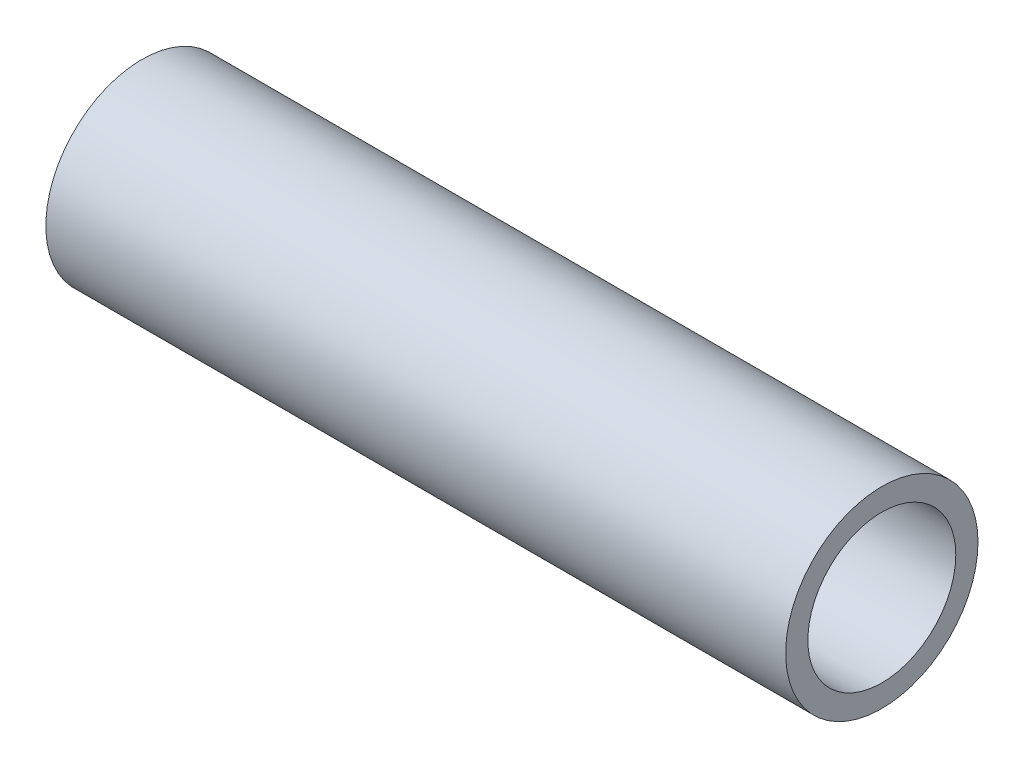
SolidWorks part; units mm, degrees
ref_plane "Front" through (0, 0, 0) normal (0, 0, 1) x (1, 0, 0)
ref_plane "Top" through (0, 0, 0) normal (0, 1, 0) x (1, 0, 0)
ref_plane "Right" through (0, 0, 0) normal (1, 0, 0) x (0, 0, -1)
sketch "Sketch1" plane through (0, 0, 0) normal (0, 0, 1) x (1, 0, 0)
  line L0 (0, 0) -> (127, 0)
  line L1 (9.9848, 0) -> (-9.9848, 0) construction
  dimension "D1" = 127
other "Structural Member1"
ref_plane "Plane1" through (0, 0, 0) normal (1, 0, 0) x (0, 0, -1)
sketch "Sketch11" plane through (0, 0, 0) normal (1, 0, 0) x (0, 0, -1)
  circle A0 centre (0, 0) radius 12.7
  circle A1 centre (0, 0) radius 16.51
  point P3 (0, 0)
  dimension "D1" = 33.02
  dimension "D2" = 25.4
